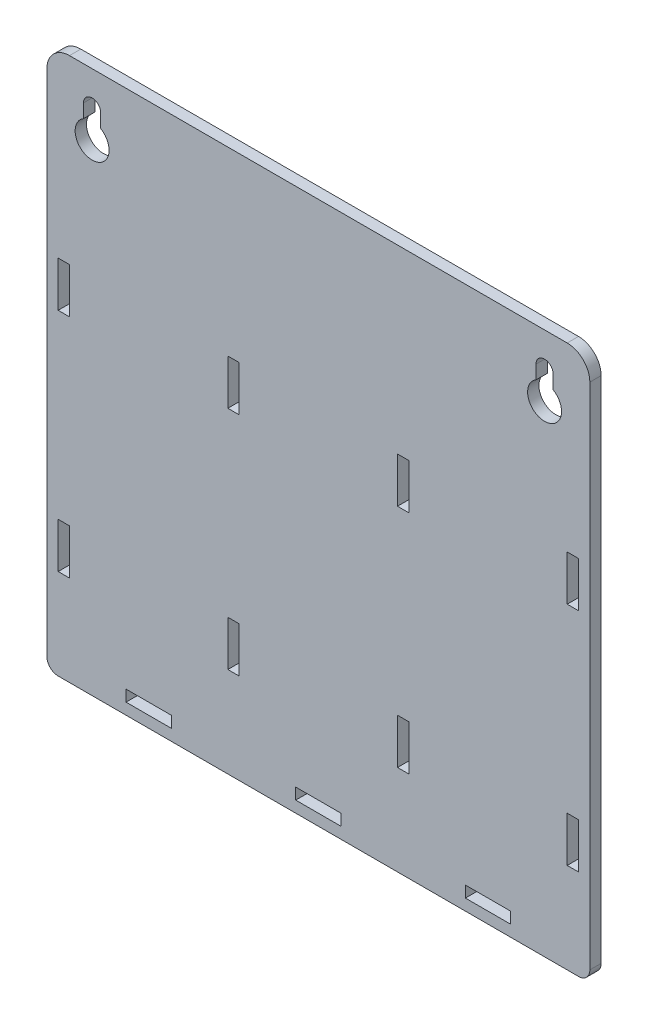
SolidWorks part; units mm, degrees
ref_plane "Front Plane" through (0, 0, 0) normal (0, 0, 1) x (1, 0, 0)
ref_plane "Top Plane" through (0, 0, 0) normal (0, 1, 0) x (1, 0, 0)
ref_plane "Right Plane" through (0, 0, 0) normal (1, 0, 0) x (0, 0, -1)
sketch "Sketch1" plane through (0, 0, 0) normal (0, 0, 1) x (1, 0, 0)
  line L0 (-76.2, 0) -> (76.2, 0)
  line L1 (69.85, 152.4) -> (-69.85, 152.4)
  line L2 (-76.2, 146.05) -> (-76.2, 0)
  line L3 (76.2, 146.05) -> (76.2, 0)
  arc A0 (76.2, 146.05) -> (69.85, 152.4) centre (69.85, 146.05) ccw
  arc A1 (-69.85, 152.4) -> (-76.2, 146.05) centre (-69.85, 146.05) ccw
  point P4 (0, 0)
extrude "Boss-Extrude1" add sketch "Sketch1" against normal blind 3.175
sketch "Sketch2" plane through (0, 0, 0) normal (0, 0, 1) x (1, 0, 0)
  line L0 (-65.913, 142.875) -> (-65.913, 139.0435)
  line L1 (-61.087, 142.875) -> (-61.087, 139.0435)
  line L2 (-63.5, 142.875) -> (-63.5, 134.9375) construction
  line L3 (69.85, 152.4) -> (-69.85, 152.4) construction
  arc A0 (-65.913, 139.0435) -> (-61.087, 139.0435) centre (-63.5, 134.9375) ccw
  arc A1 (-61.087, 142.875) -> (-65.913, 142.875) centre (-63.5, 142.875) ccw
  dimension "D2" = 4.7625
  dimension "D1" = 4.826
  dimension "D3" = 7.9375
  dimension "D4" = 63.5
  dimension "D5" = 9.525
extrude "Cut-Extrude1" cut sketch "Sketch2" against normal through all
sketch "Sketch3" plane through (0, 0, 0) normal (0, 0, 1) x (1, 0, 0)
  line L0 (-23.8125, 127) -> (-23.8125, 0) construction
  line L1 (-76.2, 0) -> (76.2, 0) construction
  line L2 (23.8125, 127) -> (23.8125, 0) construction
  line L4 (23.8125, 63.5) -> (3.9377, 63.5) construction
  line L6 (-71.4375, 127) -> (-23.8125, 127) construction
  line L7 (-71.4375, 127) -> (-71.4375, 0) construction
  line L8 (-71.4375, 127) -> (-76.2, 127) construction
  line L9 (-76.2, 146.05) -> (-76.2, 0) construction
  line L10 (71.4375, 127) -> (76.2, 127) construction
  line L11 (76.2, 0) -> (76.2, 146.05) construction
  line L12 (-23.8125, 127) -> (23.8125, 127) construction
  line L13 (-25.4, 101.6) -> (-22.225, 101.6)
  line L14 (-25.4, 101.6) -> (-25.4, 88.9)
  line L15 (-25.4, 88.9) -> (-22.225, 88.9)
  line L16 (-22.225, 101.6) -> (-22.225, 88.9)
  line L17 (-25.4, 101.6) -> (-22.225, 88.9) construction
  line L18 (-25.4, 88.9) -> (-22.225, 101.6) construction
  line L19 (-25.4, 38.1) -> (-22.225, 38.1)
  line L20 (-25.4, 38.1) -> (-25.4, 25.4)
  line L21 (-25.4, 25.4) -> (-22.225, 25.4)
  line L22 (-22.225, 38.1) -> (-22.225, 25.4)
  line L23 (-25.4, 38.1) -> (-22.225, 25.4) construction
  line L24 (-25.4, 25.4) -> (-22.225, 38.1) construction
  line L25 (-73.025, 101.6) -> (-69.85, 101.6)
  line L26 (-73.025, 101.6) -> (-73.025, 88.9)
  line L27 (-73.025, 88.9) -> (-69.85, 88.9)
  line L28 (-69.85, 101.6) -> (-69.85, 88.9)
  line L29 (-73.025, 101.6) -> (-69.85, 88.9) construction
  line L30 (-73.025, 88.9) -> (-69.85, 101.6) construction
  line L31 (-73.025, 38.1) -> (-69.85, 38.1)
  line L32 (-73.025, 38.1) -> (-73.025, 25.4)
  line L33 (-73.025, 25.4) -> (-69.85, 25.4)
  line L34 (-69.85, 38.1) -> (-69.85, 25.4)
  line L35 (-73.025, 38.1) -> (-69.85, 25.4) construction
  line L36 (-73.025, 25.4) -> (-69.85, 38.1) construction
  line L37 (23.8125, 127) -> (71.4375, 127) construction
  point P8 (-23.8125, 95.25)
  point P19 (-23.8125, 31.75)
  point P28 (-71.4375, 95.25)
  point P33 (-71.4375, 31.75)
extrude "Cut-Extrude2" cut sketch "Sketch3" against normal through all
mirror "Mirror1" about plane through (0, 0, 0) normal (1, 0, 0) of "Cut-Extrude2", "Cut-Extrude1"
sketch "Sketch4" plane through (0, 0, 0) normal (0, 0, 1) x (1, 0, 0)
  line L0 (-47.625, 4.7625) -> (0, 4.7625) construction
  line L1 (0, 4.7625) -> (47.625, 4.7625) construction
  line L3 (-41.275, 3.175) -> (-53.975, 3.175)
  line L4 (-41.275, 3.175) -> (-41.275, 6.35)
  line L5 (-41.275, 6.35) -> (-53.975, 6.35)
  line L6 (-53.975, 3.175) -> (-53.975, 6.35)
  line L7 (-41.275, 3.175) -> (-53.975, 6.35) construction
  line L8 (-41.275, 6.35) -> (-53.975, 3.175) construction
  line L9 (6.35, 3.175) -> (-6.35, 3.175)
  line L10 (6.35, 3.175) -> (6.35, 6.35)
  line L11 (6.35, 6.35) -> (-6.35, 6.35)
  line L12 (-6.35, 3.175) -> (-6.35, 6.35)
  line L13 (6.35, 3.175) -> (-6.35, 6.35) construction
  line L14 (6.35, 6.35) -> (-6.35, 3.175) construction
  line L15 (41.275, 3.175) -> (53.975, 3.175)
  line L16 (41.275, 3.175) -> (41.275, 6.35)
  line L17 (41.275, 6.35) -> (53.975, 6.35)
  line L18 (53.975, 3.175) -> (53.975, 6.35)
  line L19 (41.275, 3.175) -> (53.975, 6.35) construction
  line L20 (41.275, 6.35) -> (53.975, 3.175) construction
  line L21 (-25.4, 38.1) -> (-25.4, 25.4) construction
  line L22 (-25.4, 25.4) -> (-22.225, 25.4) construction
  line L23 (-76.2, 0) -> (76.2, 0) construction
  line L24 (-71.4375, 63.5) -> (-23.8125, 63.5) construction
  line L25 (-71.4375, 127) -> (-71.4375, 0) construction
  line L26 (-23.8125, 127) -> (-23.8125, 0) construction
  line L27 (-47.625, 63.5) -> (-47.625, 4.7625) construction
  point P12 (47.625, 4.7625)
extrude "Cut-Extrude3" cut sketch "Sketch4" against normal through all
fillet "Fillet1" radius 3.175 2 edges at (76.2, 0, -1.5875) (-76.2, 0, -1.5875)
equation "\"h\"= 5"
equation "\"D3@Sketch1\"=\"h\"+1"
equation "\"plywoodThickness\"= .125"
equation "\"jointClearance\"= .000"
equation "\"D1@Sketch3\"=\"plywoodThickness\"*1.5"
equation "\"D2@Sketch3\"=\"h\""
equation "\"D3@Sketch3\"=\"jointClearance\"+.5"
equation "\"D4@Sketch3\"=\"plywoodThickness\"+\"jointClearance\""
equation "\"D5@Sketch3\"=\"h\"/2"
equation "\"D1@Sketch4\"= \"plywoodThickness\" * 1.5"
equation "\"D1@Fillet1\"=\"plywoodThickness\""
